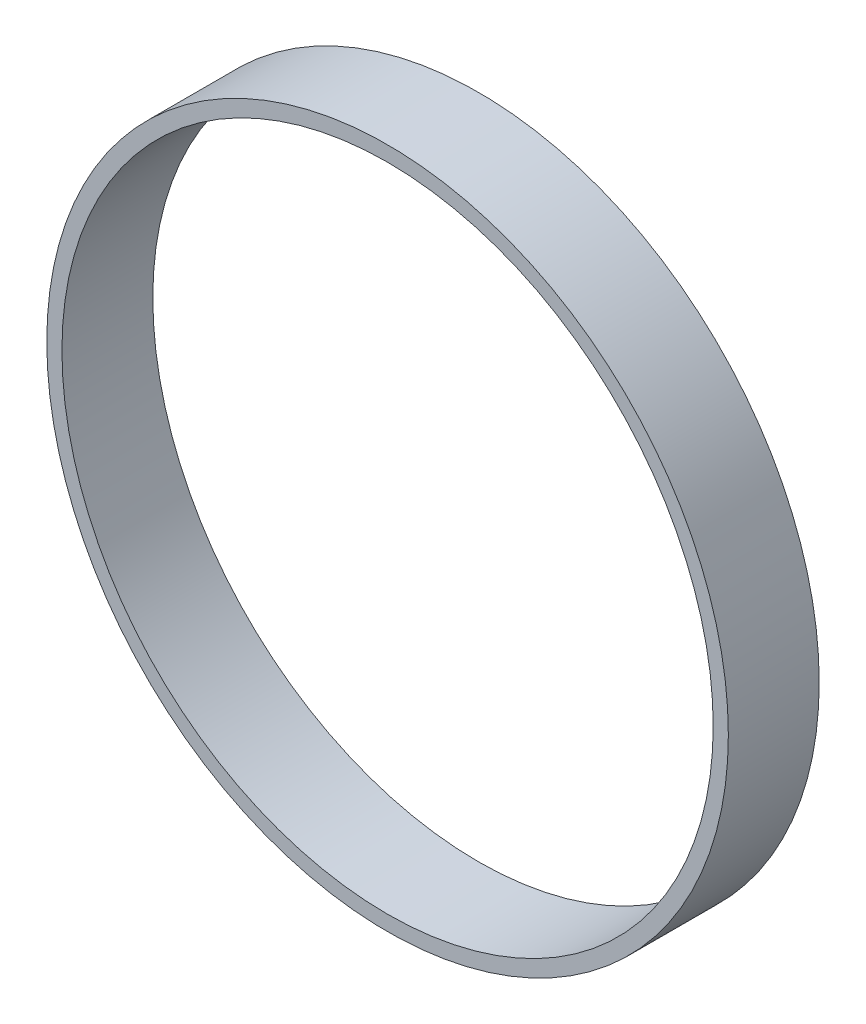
SolidWorks part; units mm, degrees
ref_plane "前视基准面" through (0, 0, 0) normal (0, 0, 1) x (1, 0, 0)
ref_plane "上视基准面" through (0, 0, 0) normal (0, 1, 0) x (1, 0, 0)
ref_plane "右视基准面" through (0, 0, 0) normal (1, 0, 0) x (0, 0, -1)
imported_body "装配体1.STEP"
delete or keep bodies "实体-删除/保留 1" type delete bodies bodies 154
sketch "草图2" plane through (0, 0, -20.2213) normal (0, 0, -1) x (-1, 0, 0)
  circle A0 centre (111.0244, 0) radius 83
  dimension "D1" = 166
extrude "切除-拉伸1" cut sketch "草图2" against normal through all flip side to cut
sketch "草图3" plane through (0, 0, -5.2213) normal (0, 0, -1) x (-1, 0, 0)
  circle A0 centre (111.0244, 0) radius 45
  circle A1 centre (111.0244, 0) radius 43
extrude "凸台-拉伸1" add sketch "草图3" along normal blind 12 separate body
